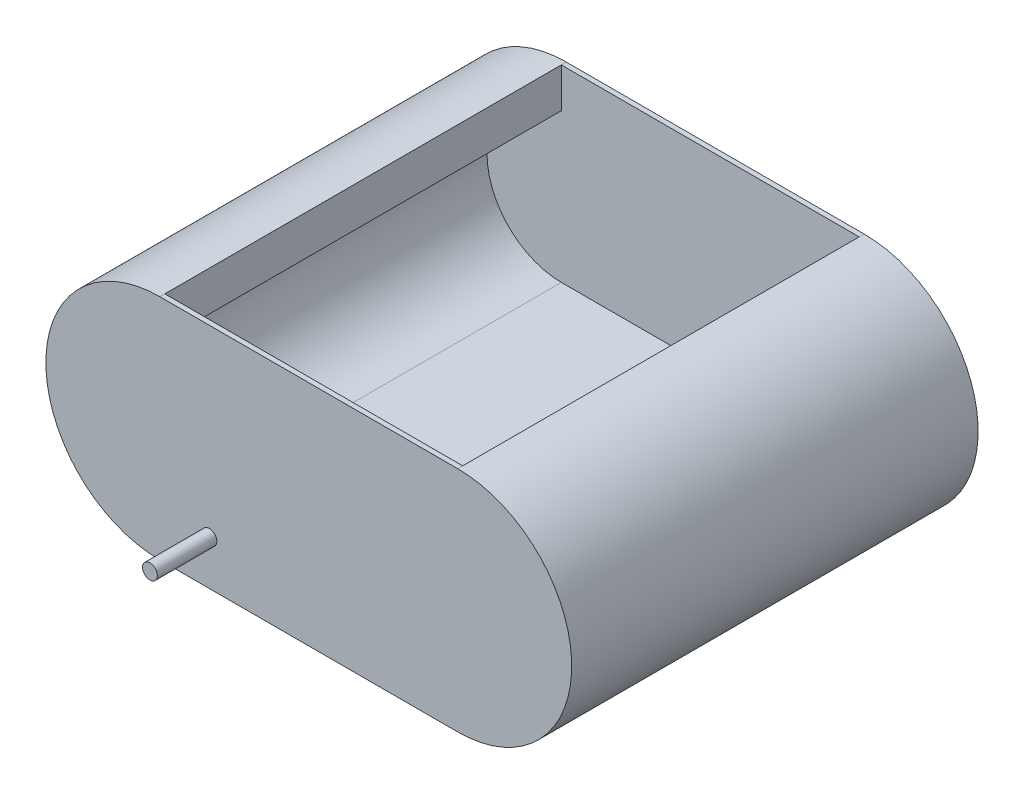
SolidWorks part; units mm, degrees
ref_plane "Alzado" through (0, 0, 0) normal (0, 0, 1) x (1, 0, 0)
ref_plane "Planta" through (0, 0, 0) normal (0, 1, 0) x (1, 0, 0)
ref_plane "Vista lateral" through (0, 0, 0) normal (1, 0, 0) x (0, 0, -1)
sketch "Croquis2" plane through (0, 0, 0) normal (0, 0, 1) x (1, 0, 0)
  line L0 (0, 0) -> (600.9049, 0) construction
  line L2 (0, -230) -> (600.9049, -230)
  line L3 (0, 0) -> (600.9049, 0) construction
  line L5 (0, -150) -> (600.9049, -150)
  line L6 (600.9049, 150) -> (600.9049, 230)
  line L7 (0, 150) -> (0, 230)
  arc A0 (0, 230) -> (0, -230) centre (0, 0) ccw
  arc A1 (600.9049, -230) -> (600.9049, 230) centre (600.9049, 0) ccw
  arc A2 (0, 150) -> (0, -150) centre (0, 0) ccw
  arc A3 (600.9049, -150) -> (600.9049, 150) centre (600.9049, 0) ccw
  point P3 (300.4524, 0)
  point P8 (300.4524, 0)
  dimension "D1" = 230
  dimension "D2" = 150
extrude "Saliente-Extruir2" add sketch "Croquis2" along normal blind 800
sketch "Croquis3" plane through (0, 0, 800) normal (0, 0, 1) x (1, 0, 0)
  line L0 (0, 150) -> (600.9049, 150)
  line L1 (0, 230) -> (600.9049, 230)
  line L4 (0, -230) -> (600.9049, -230)
  line L5 (600.9049, 230) -> (600.9049, 150)
  line L6 (600.9049, -150) -> (0, -150)
  line L7 (0, 150) -> (0, 230)
  line L8 (0, -230) -> (600.9049, -230)
  line L9 (600.9049, 230) -> (600.9049, 150)
  line L10 (600.9049, -150) -> (0, -150)
  line L11 (0, 150) -> (0, 230)
  arc A4 (0, 230) -> (0, -230) centre (0, 0) ccw
  arc A5 (600.9049, -230) -> (600.9049, 230) centre (600.9049, 0) ccw
  arc A6 (600.9049, -150) -> (600.9049, 150) centre (600.9049, 0) ccw
  arc A7 (0, 150) -> (0, -150) centre (0, 0) ccw
  arc A8 (0, 230) -> (0, -230) centre (0, 0) ccw
  arc A9 (600.9049, -230) -> (600.9049, 230) centre (600.9049, 0) ccw
  arc A10 (600.9049, -150) -> (600.9049, 150) centre (600.9049, 0) ccw
  arc A11 (0, 150) -> (0, -150) centre (0, 0) ccw
  dimension "D1" = 0
extrude "Saliente-Extruir3" add sketch "Croquis3" along normal blind 10 contours L1 L0 M16 M12 | M16 M9 M10 M11 M12 M13 M14 M15 | L0 M15 M14 M13
sketch "Croquis4" plane through (0, 0, 0) normal (0, 0, -1) x (-1, 0, 0)
  line L0 (-600.9049, 150) -> (0, 150)
  line L1 (-600.9049, 230) -> (0, 230)
  line L4 (0, 230) -> (0, 150)
  line L5 (0, -150) -> (-600.9049, -150)
  line L6 (-600.9049, 150) -> (-600.9049, 230)
  line L7 (-600.9049, -230) -> (0, -230)
  line L8 (0, 230) -> (0, 150)
  line L9 (0, -150) -> (-600.9049, -150)
  line L10 (-600.9049, 150) -> (-600.9049, 230)
  line L11 (-600.9049, -230) -> (0, -230)
  arc A4 (0, -230) -> (0, 230) centre (0, 0) ccw
  arc A5 (0, -150) -> (0, 150) centre (0, 0) ccw
  arc A6 (-600.9049, 150) -> (-600.9049, -150) centre (-600.9049, 0) ccw
  arc A7 (-600.9049, 230) -> (-600.9049, -230) centre (-600.9049, 0) ccw
  arc A8 (0, -230) -> (0, 230) centre (0, 0) ccw
  arc A9 (0, -150) -> (0, 150) centre (0, 0) ccw
  arc A10 (-600.9049, 150) -> (-600.9049, -150) centre (-600.9049, 0) ccw
  arc A11 (-600.9049, 230) -> (-600.9049, -230) centre (-600.9049, 0) ccw
  dimension "D1" = 0
extrude "Saliente-Extruir4" add sketch "Croquis4" along normal blind 10 contours L0 M13 M12 M11 | L1 L0 M14 M10 | M16 M9 M10 M11 M12 M13 M14 M15
sketch "Croquis5" plane through (0, 0, 810) normal (0, 0, 1) x (1, 0, 0)
  line L0 (-438.6112, -140) -> (1028.2154, -140) construction
  line L1 (0, -230) -> (600.9049, -230) construction
  circle A0 centre (100, -140) radius 15
  dimension "D1" = 30
  dimension "D4" = 90
  dimension "D5" = 100
extrude "Saliente-Extruir5" add sketch "Croquis5" along normal blind 120
sketch "Croquis6" plane through (0, 0, -10) normal (0, 0, -1) x (-1, 0, 0)
  line L0 (-940.0702, -140) -> (437.4811, -140) construction
  line L2 (-600.9049, -230) -> (0, -230) construction
  line L4 (-1020.5301, -140) -> (446.2965, -140) construction
  circle A1 centre (-100, -140) radius 15
  dimension "D2" = 0
  dimension "D3" = 30
  dimension "D1" = 90
  dimension "D5" = 100
extrude "Saliente-Extruir6" add sketch "Croquis6" along normal blind 120
